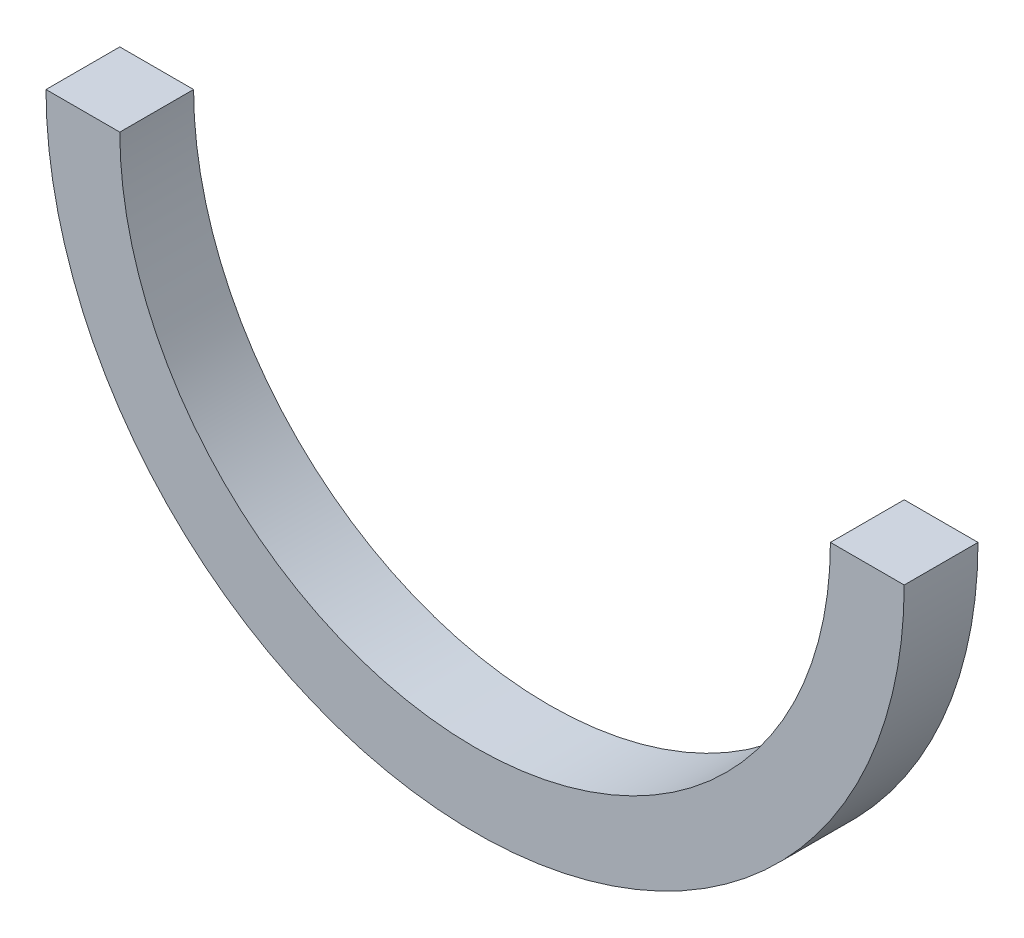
SolidWorks part; units mm, degrees
ref_plane "Front Plane" through (0, 0, 0) normal (0, 0, 1) x (1, 0, 0)
ref_plane "Top Plane" through (0, 0, 0) normal (0, 1, 0) x (1, 0, 0)
ref_plane "Right Plane" through (0, 0, 0) normal (1, 0, 0) x (0, 0, -1)
sketch "Sketch1" plane through (0, 0, 0) normal (0, 0, 1) x (1, 0, 0)
  arc A0 (97, 0) -> (-97, 0) centre (0, 0) cw
  dimension "D1" = 97
sketch "Sketch2" plane through (0, 0, 0) normal (0, 1, 0) x (1, 0, 0)
  line L0 (-97, 0) -> (97, 0) construction
  line L1 (-106.125, -9.125) -> (-87.875, -9.125)
  line L2 (-106.125, -9.125) -> (-106.125, 9.125)
  line L3 (-106.125, 9.125) -> (-87.875, 9.125)
  line L4 (-87.875, -9.125) -> (-87.875, 9.125)
  line L5 (-106.125, -9.125) -> (-87.875, 9.125) construction
  line L6 (-106.125, 9.125) -> (-87.875, -9.125) construction
  point P0 (-97, 0)
  point P7 (-113.6069, 0)
  dimension "D1" = 18.25
  dimension "D2" = 18.25
sweep "Sweep1" add profiles "Sketch2" path "Sketch1"
